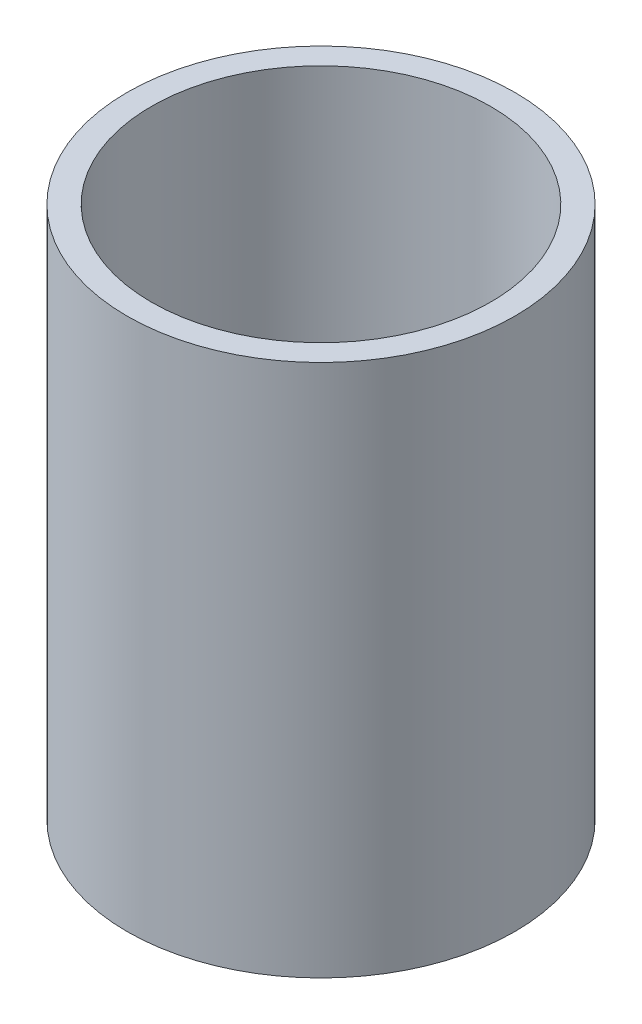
SolidWorks part; units mm, degrees
ref_plane "Front Plane" through (0, 0, 0) normal (0, 0, 1) x (1, 0, 0)
ref_plane "Top Plane" through (0, 0, 0) normal (0, 1, 0) x (1, 0, 0)
ref_plane "Right Plane" through (0, 0, 0) normal (1, 0, 0) x (0, 0, -1)
sketch "Sketch1" plane through (0, 0, 0) normal (0, 1, 0) x (1, 0, 0)
  circle A0 centre (0, 0) radius 40
  circle A1 centre (0, 0) radius 35
  dimension "D1" = 80
  dimension "D2" = 70
extrude "Boss-Extrude1" add sketch "Sketch1" along normal blind 110
